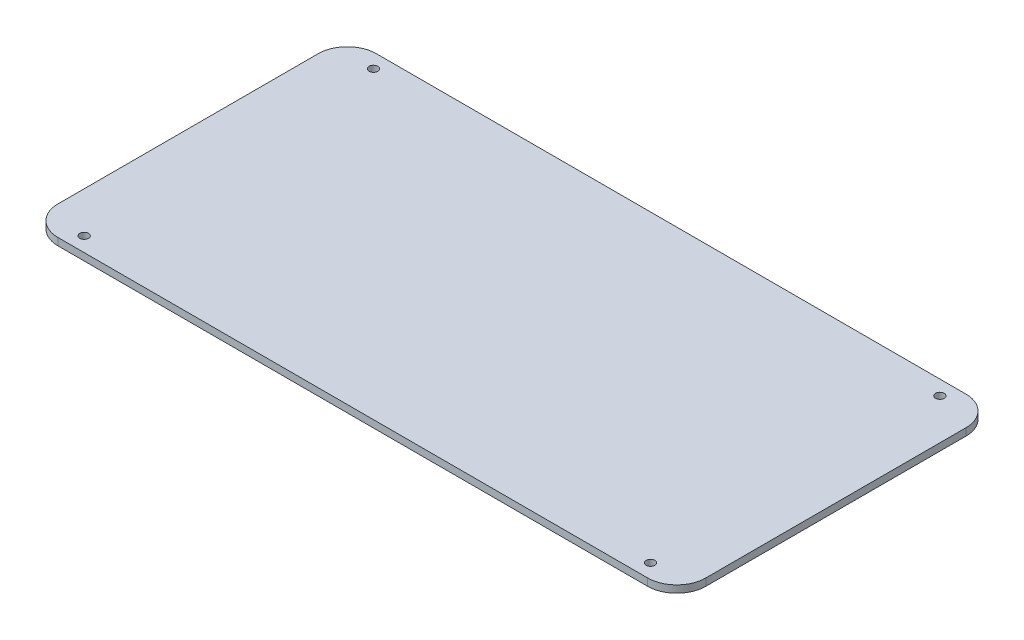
SolidWorks part; units mm, degrees
ref_plane "Front Plane" through (0, 0, 0) normal (0, 0, 1) x (1, 0, 0)
ref_plane "Top Plane" through (0, 0, 0) normal (0, 1, 0) x (1, 0, 0)
ref_plane "Right Plane" through (0, 0, 0) normal (1, 0, 0) x (0, 0, -1)
sketch "Sketch1" plane through (0, 0, 0) normal (0, 1, 0) x (1, 0, 0)
  line L1 (-111.405, 54.75) -> (111.405, 54.75)
  line L2 (-111.405, 54.75) -> (-111.405, -54.75)
  line L3 (-111.405, -54.75) -> (111.405, -54.75)
  line L4 (111.405, 54.75) -> (111.405, -54.75)
  line L5 (-111.405, 54.75) -> (111.405, -54.75) construction
  line L6 (-111.405, -54.75) -> (111.405, 54.75) construction
  point P0 (0, 0)
  dimension "D1" = 222.81
  dimension "D2" = 109.5
extrude "Boss-Extrude1" add sketch "Sketch1" along normal blind 2.5
fillet "Fillet1" radius 10 4 edges at (111.405, 1.25, 54.75) (111.405, 1.25, -54.75) (-111.405, 1.25, -54.75) (-111.405, 1.25, 54.75)
sketch "Sketch2" plane through (0, 0, 0) normal (0, 1, 0) x (1, 0, 0)
  line L0 (101.405, 54.75) -> (-101.405, 54.75) construction
  line L1 (-101.405, -54.75) -> (101.405, -54.75) construction
  line L2 (-111.405, 44.75) -> (-111.405, -44.75) construction
  line L3 (111.405, -44.75) -> (111.405, 44.75) construction
  circle A0 centre (-97.405, 49.75) radius 1.5
  circle A1 centre (-97.405, -49.75) radius 1.5
  circle A2 centre (97.405, 49.75) radius 1.5
  circle A3 centre (97.405, -49.75) radius 1.5
  dimension "D1" = 3
  dimension "D2" = 3
  dimension "D3" = 3
  dimension "D4" = 3
  dimension "D5" = 5
  dimension "D6" = 5
  dimension "D7" = 5
  dimension "D8" = 5
  dimension "D9" = 14
  dimension "D10" = 14
  dimension "D11" = 14
  dimension "D12" = 14
extrude "Cut-Extrude4" cut sketch "Sketch2" against normal blind 4.5 and the other way blind 8
